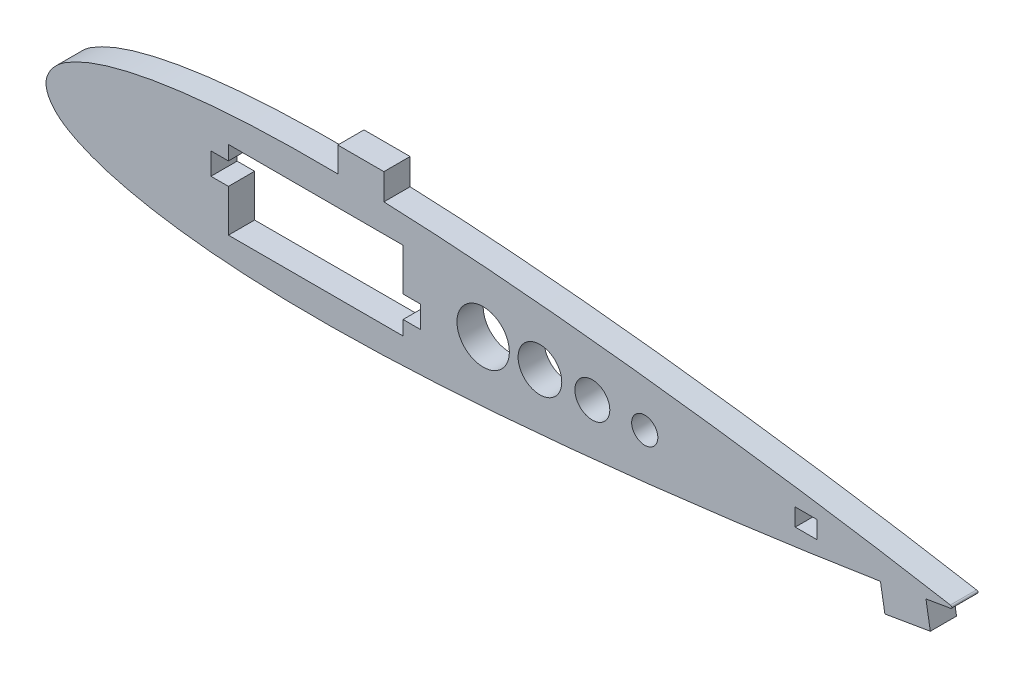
SolidWorks part; units mm, degrees
other "Marca1"
sketch "Croquis4" plane through (-0.5751, -7.5477, 3) normal (0, 0, 1) x (1, 0, 0)
ref_plane "Alzado" through (0, 0, 0) normal (0, 0, 1) x (1, 0, 0)
ref_plane "Planta" through (0, 0, 0) normal (0, 1, 0) x (1, 0, 0)
ref_plane "Vista lateral" through (0, 0, 0) normal (1, 0, 0) x (0, 0, -1)
curve "Curva1"
sketch "Croquis1" plane through (0, 0, 0) normal (0, 0, 1) x (1, 0, 0)
  line L0 (91.9959, -1.499) -> (92.5031, -4.4801)
  line L1 (92.5031, -4.4801) -> (97.7083, -3.5946)
  line L2 (97.7083, -3.5946) -> (97.2051, -0.637)
  line L3 (-3.5412, 0) -> (-3.5412, 11.7562) construction
  line L5 (29.863, 10.7009) -> (35.143, 10.7009)
  line L6 (29.863, 10.7009) -> (29.863, 7.8365)
  line L8 (35.143, 10.7009) -> (35.143, 7.7009)
  arc A1 (100, 0.158) -> (100, -0.158) centre (100.0082, 0) cw
  spline S0 degree 3 poles (97.2051, -0.637) (98.137, -0.4785) (99.0685, -0.3183) (100, -0.158) knots 0.986199 0.986199 0.986199 0.986199 1 1 1 1
  spline S1 degree 3 poles (29.863, 7.8365) (29.0849, 7.8469) (26.5806, 7.8659) (22.3482, 7.8136) (17.1648, 7.564) (11.9741, 7.0776) (7.6523, 6.3931) (4.2005, 5.5769) (1.5793, 4.7574) (-0.6246, 3.7615) (-2.6036, 2.4426) (-4.1403, 0.1259) (-2.6094, -2.1946) (-0.6338, -3.5185) (1.5676, -4.5199) (4.1867, -5.3461) (7.6364, -6.1709) (11.9565, -6.8664) (17.146, -7.3659) (22.3287, -7.6285) (29.2354, -7.7315) (37.8729, -7.5032) (48.2298, -6.8371) (58.5855, -5.894) (68.9413, -4.7372) (79.2983, -3.4016) (86.9807, -2.2839) (91.2119, -1.6232) (91.9959, -1.499) knots 0.33193 0.33193 0.33193 0.33193 0.342904 0.367241 0.391608 0.416059 0.440726 0.453243 0.466028 0.479473 0.486972 0.5 0.513028 0.520527 0.533972 0.546757 0.559274 0.583941 0.608392 0.632759 0.657096 0.705781 0.75455 0.803422 0.852398 0.901478 0.95067 0.961864 0.961864 0.961864 0.961864
  spline S2 degree 3 poles (100, 0.158) (98.2752, 0.457) (94.8283, 1.0545) (87.9303, 2.1659) (79.307, 3.4427) (68.9533, 4.8044) (58.6005, 5.9874) (48.2473, 6.9566) (40.4254, 7.4796) (36.0564, 7.6668) (35.143, 7.7009) knots 0 0 0 0 0.024684 0.04933 0.098522 0.147602 0.196578 0.24545 0.294219 0.307106 0.307106 0.307106 0.307106
extrude "Saliente-Extruir1" add sketch "Croquis1" along normal blind 3
sketch "Croquis3" plane through (0, 0, 3) normal (0, 0, 1) x (1, 0, 0)
  line L0 (0, -7.9791) -> (100, -7.9791) construction
  line L1 (82.2397, 1) -> (84.7597, 1)
  line L2 (82.2397, 1) -> (82.2397, -1)
  line L3 (82.2397, -1) -> (84.7597, -1)
  line L4 (84.7597, 1) -> (84.7597, -1)
  line L5 (17.3415, 4.5) -> (37.3415, 4.5)
  line L6 (17.3415, 4.5) -> (17.3415, 2.86)
  line L7 (17.3415, -4.5) -> (37.3415, -4.5)
  line L8 (37.3415, 4.5) -> (37.3415, -0.34)
  line L33 (17.3415, 0.34) -> (17.3415, -4.5)
  line L34 (15.3415, 2.86) -> (17.3415, 2.86)
  line L35 (15.3415, 2.86) -> (15.3415, 0.34)
  line L36 (15.3415, 0.34) -> (17.3415, 0.34)
  line L38 (37.3415, -2.86) -> (37.3415, -4.5)
  line L39 (37.3415, -0.34) -> (39.3415, -0.34)
  line L41 (37.3415, -2.86) -> (39.3415, -2.86)
  line L42 (39.3415, -0.34) -> (39.3415, -2.86)
  circle A0 centre (46.5082, 0) radius 3
  circle A1 centre (53.0082, 0) radius 2.5
  circle A2 centre (59.0082, 0) radius 2
  circle A3 centre (65.0082, 0) radius 1.5
  arc A4 (100, -0.158) -> (100, 0.158) centre (100.0082, 0) ccw construction
  arc A5 (100, -0.158) -> (100, 0.158) centre (100.0082, 0) ccw construction
  point P20 (27.3415, 4.5)
  point P51 (100.1664, 0)
  point P52 (83.4997, 1)
extrude "Cortar-Extruir1" cut sketch "Croquis3" against normal blind 10
equation "\"leng\"=2"
equation "\"D9@Croquis3\"=\"leng\""
equation "\"mat\"=3"
equation "\"pla1\"= 20"
equation "\"D12@Croquis3\"=\"pla1\""
equation "\"pla2\"= 9"
equation "\"D13@Croquis3\"=\"pla2\""
equation "\"D14@Croquis3\"=\"pla2\"/2"
equation "\"escala\"=100"
equation "\"D16@Croquis3\"=\"escala\""
equation "\"D15@Croquis3\"=6+(2*\"escala\"/3)"
equation "\"D11@Croquis3\"=\"leng\"/2"
equation "\"kerf\"= .24"
equation "\"D1@Croquis1\"=\"mat\""
equation "\"D28@Croquis3\"=\"escala\"/6"
equation "\"prof\"=2"
equation "\"D17@Croquis3\"=\"prof\""
equation "\"D18@Croquis3\"=\"mat\"-(2*\"kerf\")"
equation "\"D21@Croquis3\"=\"mat\"-(2*\"kerf\")"
equation "\"D10@Croquis3\"=\"mat\"-(2*\"kerf\")"
equation "\"D3@Croquis1\"=\"mat\""
